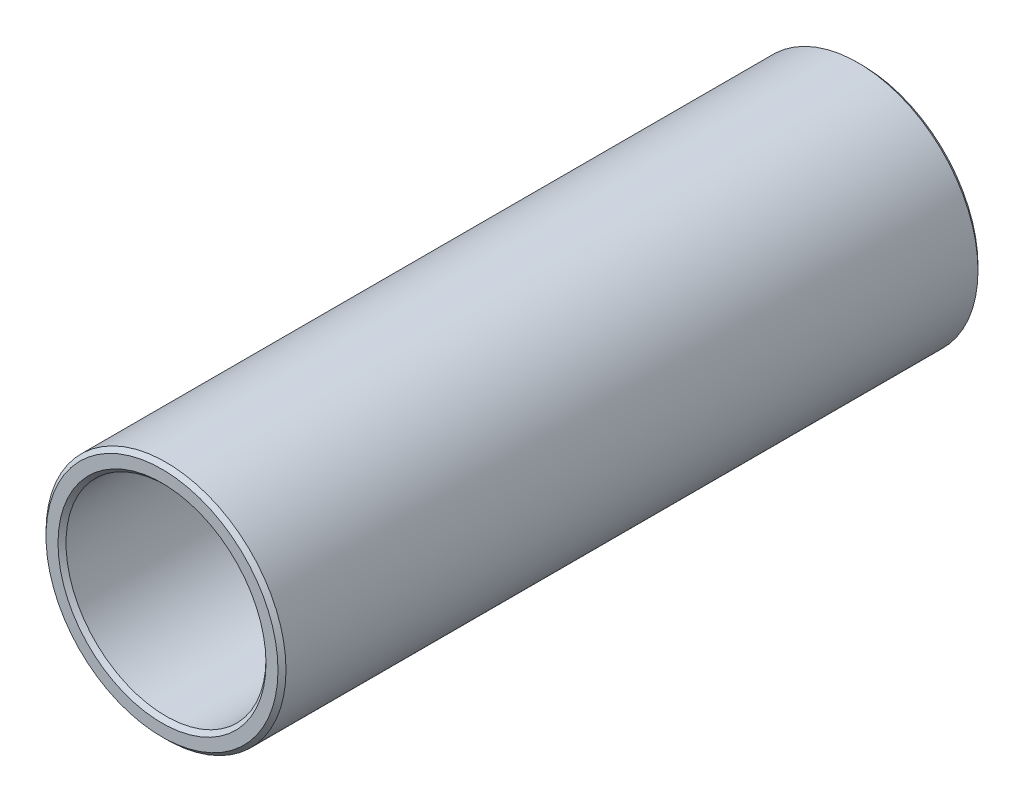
SolidWorks part; units mm, degrees
ref_plane "Спереди" through (0, 0, 0) normal (0, 0, 1) x (1, 0, 0)
ref_plane "Сверху" through (0, 0, 0) normal (0, 1, 0) x (1, 0, 0)
ref_plane "Справа" through (0, 0, 0) normal (1, 0, 0) x (0, 0, -1)
sketch "Эскиз1" plane through (0, 0, 0) normal (0, 0, 1) x (1, 0, 0)
  circle A0 centre (0, 0) radius 6
  circle A1 centre (0, 0) radius 5
  dimension "D1" = 12
  dimension "D2" = 10
extrude "Бобышка-Вытянуть1" add sketch "Эскиз1" along normal blind 35
chamfer "Фаска1" distance 0.2 angle 45 4 edges at (5, 0, 0) (5, 0, 35) (6, 0, 0) (6, 0, 35)
